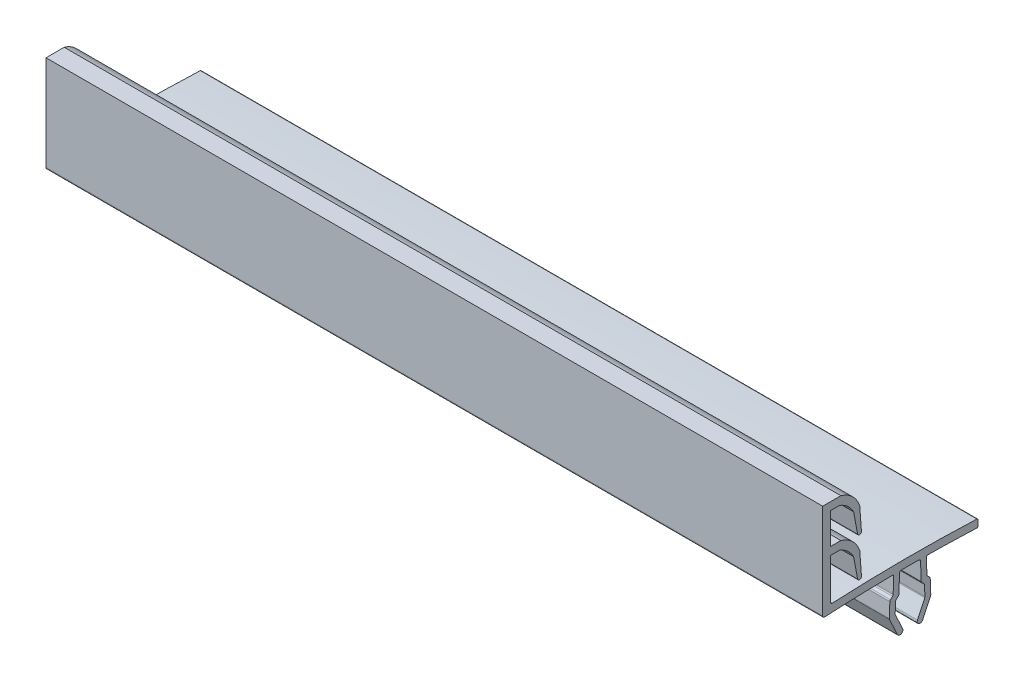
SolidWorks part; units mm, degrees
ref_plane "Front Plane" through (0, 0, 0) normal (0, 0, 1) x (1, 0, 0)
ref_plane "Top Plane" through (0, 0, 0) normal (0, 1, 0) x (1, 0, 0)
ref_plane "Right Plane" through (0, 0, 0) normal (1, 0, 0) x (0, 0, -1)
sketch3d "3DSketch1"
  line L0 (0, 0, 0) -> (200, 0, 0)
  dimension "D1" = 200
other "Kehystiivisteet 1.6041 KEHYSTIIVISTE(1)"
ref_plane "Plane1" through (0, 0, 0) normal (1, 0, 0) x (0, 0, -1)
sketch "Sketch1" plane through (0, 0, 0) normal (1, 0, 0) x (0, 0, -1)
  line L0 (-9.822, 17.3739) -> (-14.5083, 17.3739)
  line L1 (-14.5083, 17.3739) -> (-14.5083, -7.0975)
  line L2 (3.7941, -7.3296) -> (3.6382, -11.3898)
  line L3 (3.4782, -11.7375) -> (2.952, -12.2248)
  line L4 (2.7921, -12.5724) -> (2.65, -16.2732)
  line L5 (2.6964, -16.5037) -> (4.7252, -20.8545)
  line L6 (6.0847, -20.2206) -> (4.2093, -16.1987)
  line L7 (4.1628, -15.9682) -> (4.2672, -13.2509)
  line L8 (4.4271, -12.9032) -> (4.9533, -12.4159)
  line L9 (5.1132, -12.0683) -> (5.2895, -7.4796)
  line L10 (10.6939, -7.4796) -> (10.8702, -12.0683)
  line L11 (11.0301, -12.4159) -> (11.5563, -12.9032)
  line L12 (11.7162, -13.2509) -> (11.8206, -15.9682)
  line L13 (11.7741, -16.1987) -> (9.8987, -20.2206)
  line L14 (11.2582, -20.8545) -> (13.287, -16.5037)
  line L15 (13.3334, -16.2732) -> (13.1913, -12.5724)
  line L16 (13.0314, -12.2248) -> (12.5052, -11.7375)
  line L17 (12.3453, -11.3898) -> (12.1893, -7.3296)
  line L18 (25.4917, -7.0625) -> (25.4917, -5.6612)
  line L19 (-12.5083, -4.99) -> (-12.5083, 5.3739)
  line L20 (-12.5083, 5.3739) -> (-10.137, 5.3739)
  line L21 (-6.5433, 2.1396) -> (-5.514, -3.3424)
  line L22 (-4.524, -3.2136) -> (-4.955, 2.6556)
  line L23 (-9.822, 7.3739) -> (-12.5083, 7.3739)
  line L24 (-12.5083, 7.3739) -> (-12.5083, 15.3739)
  line L25 (-12.5083, 15.3739) -> (-10.137, 15.3739)
  line L26 (-6.5433, 12.1396) -> (-5.514, 6.6576)
  line L27 (-4.524, 6.7864) -> (-4.955, 12.6556)
  arc A0 (-14.5083, -7.0975) -> (-13.9808, -7.5967) centre (-14.0083, -7.0975) ccw
  arc A1 (3.491, -7.0181) -> (-13.9808, -7.5967) centre (7.9917, -406.9927) ccw
  arc A2 (3.7941, -7.3296) -> (3.491, -7.0181) centre (3.4944, -7.3181) ccw
  arc A3 (3.4782, -11.7375) -> (3.6382, -11.3898) centre (3.1385, -11.3706) ccw
  arc A4 (2.952, -12.2248) -> (2.7921, -12.5724) centre (3.2918, -12.5916) ccw
  arc A5 (2.65, -16.2732) -> (2.6964, -16.5037) centre (3.1496, -16.2924) ccw
  arc A6 (4.7252, -20.8545) -> (6.0847, -20.2206) centre (5.405, -20.5375) ccw
  arc A7 (4.1628, -15.9682) -> (4.2093, -16.1987) centre (4.6624, -15.9874) ccw
  arc A8 (4.4271, -12.9032) -> (4.2672, -13.2509) centre (4.7668, -13.2701) ccw
  arc A9 (4.9533, -12.4159) -> (5.1132, -12.0683) centre (4.6136, -12.0491) ccw
  arc A10 (5.7863, -6.9988) -> (5.2895, -7.4796) centre (5.7891, -7.4988) ccw
  arc A11 (10.1971, -6.9988) -> (5.7863, -6.9988) centre (7.9917, -406.9929) ccw
  arc A12 (10.6939, -7.4796) -> (10.1971, -6.9988) centre (10.1943, -7.4988) ccw
  arc A13 (10.8702, -12.0683) -> (11.0301, -12.4159) centre (11.3698, -12.0491) ccw
  arc A14 (11.7162, -13.2509) -> (11.5563, -12.9032) centre (11.2166, -13.2701) ccw
  arc A15 (11.7741, -16.1987) -> (11.8206, -15.9682) centre (11.321, -15.9874) ccw
  arc A16 (9.8987, -20.2206) -> (11.2582, -20.8545) centre (10.5784, -20.5375) ccw
  arc A17 (13.287, -16.5037) -> (13.3334, -16.2732) centre (12.8338, -16.2924) ccw
  arc A18 (13.1913, -12.5724) -> (13.0314, -12.2248) centre (12.6916, -12.5916) ccw
  arc A19 (12.3453, -11.3898) -> (12.5052, -11.7375) centre (12.8449, -11.3706) ccw
  arc A20 (12.4924, -7.0181) -> (12.1893, -7.3296) centre (12.4891, -7.3181) ccw
  arc A21 (25.1788, -7.3622) -> (12.4924, -7.0181) centre (7.9917, -406.9928) ccw
  arc A22 (25.1788, -7.3622) -> (25.4917, -7.0625) centre (25.1917, -7.0625) ccw
  arc A23 (25.4917, -5.6612) -> (25.2045, -5.3614) centre (25.1917, -5.6612) ccw
  arc A24 (25.2045, -5.3614) -> (-11.9835, -5.4894) centre (7.9917, -406.9928) ccw
  arc A25 (-12.5083, -4.99) -> (-11.9835, -5.4894) centre (-12.0083, -4.99) ccw
  arc A26 (-6.5433, 2.1396) -> (-10.137, 5.3739) centre (-12.5943, -0.97) ccw
  arc A27 (-5.514, -3.3424) -> (-4.524, -3.2136) centre (-5.0226, -3.2502) ccw
  arc A28 (-4.955, 2.6556) -> (-9.822, 7.3739) centre (-11.8138, 0.45) ccw
  arc A29 (-6.5433, 12.1396) -> (-10.137, 15.3739) centre (-12.5943, 9.03) ccw
  arc A30 (-5.514, 6.6576) -> (-4.524, 6.7864) centre (-5.0226, 6.7498) ccw
  arc A31 (-4.955, 12.6556) -> (-9.822, 17.3739) centre (-11.8138, 10.45) ccw
  point P92 (0, 0)
